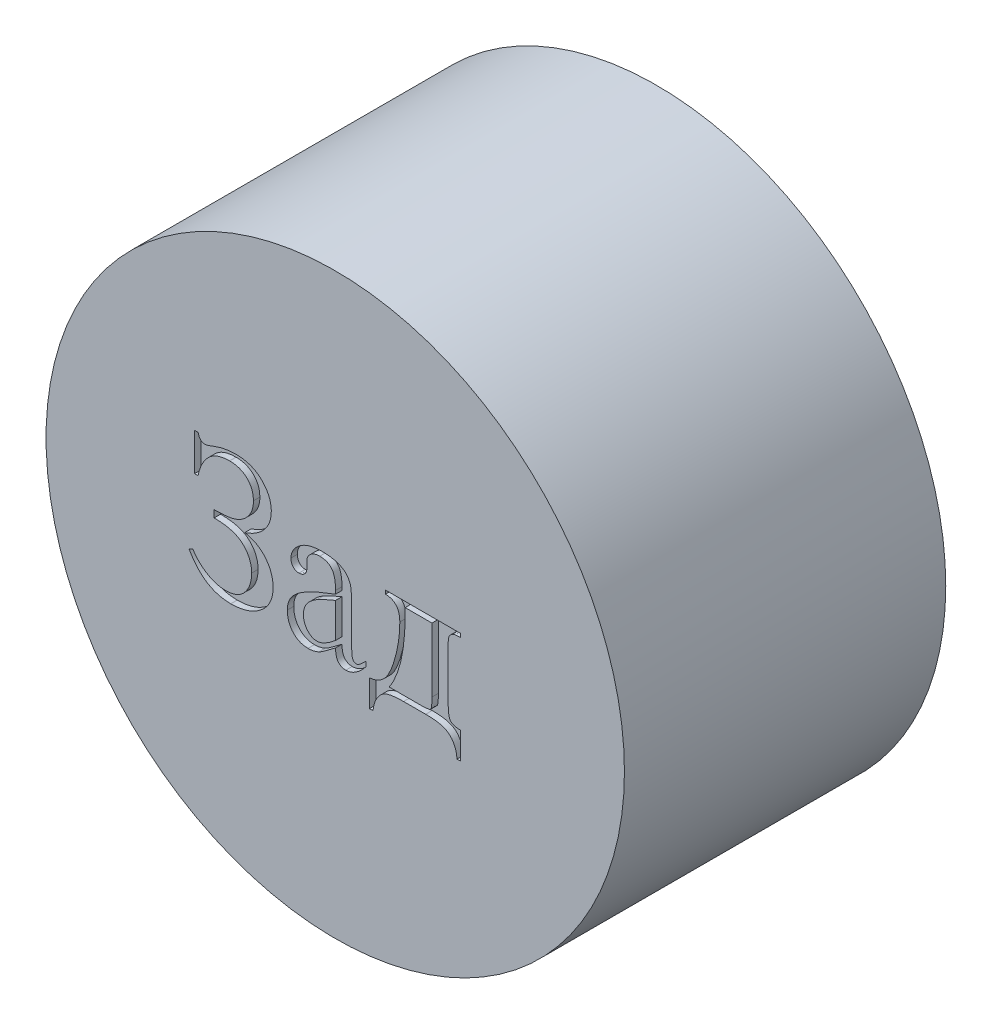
SolidWorks part; units mm, degrees
ref_plane "Спереди" through (0, 0, 0) normal (0, 0, 1) x (1, 0, 0)
ref_plane "Сверху" through (0, 0, 0) normal (0, 1, 0) x (1, 0, 0)
ref_plane "Справа" through (0, 0, 0) normal (1, 0, 0) x (0, 0, -1)
sketch "Эскиз1" plane through (0, 0, 0) normal (0, 0, 1) x (1, 0, 0)
  circle A0 centre (0, 0) radius 45
  dimension "D1" = 90
extrude "Бобышка-Вытянуть1" add sketch "Эскиз1" along normal blind 50
sketch "Эскиз2" plane through (0, 0, 50) normal (0, 0, 1) x (1, 0, 0)
  text T0 "Зад" font "Times New Roman" height 20
extrude "Вырез-Вытянуть1" cut sketch "Эскиз2" against normal blind 1
sketch "Эскиз3" plane through (0, 0, 0) normal (0, 0, -1) x (-1, 0, 0)
  text T0 "Перед" font "Times New Roman" height 20
extrude "Вырез-Вытянуть2" cut sketch "Эскиз3" against normal blind 1
